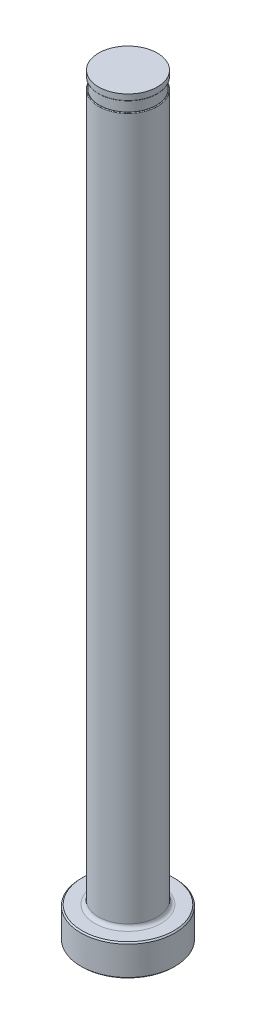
SolidWorks part; units mm, degrees
ref_plane "Front Plane" through (0, 0, 0) normal (0, 0, 1) x (1, 0, 0)
ref_plane "Top Plane" through (0, 0, 0) normal (0, 1, 0) x (1, 0, 0)
ref_plane "Right Plane" through (0, 0, 0) normal (1, 0, 0) x (0, 0, -1)
other "Configuration Table"
sketch "Sketch1" plane through (0, 0, 0) normal (0, 0, 1) x (1, 0, 0)
  line L0 (0, 259.9588) -> (0, -15.1925) construction
  line L1 (0, 0) -> (-9.525, 0)
  line L2 (-9.525, 0) -> (-9.525, 6.35)
  line L3 (-9.525, 6.35) -> (-5.9525, 6.35)
  line L4 (-5.9525, 6.35) -> (-5.9525, 152.4)
  line L5 (-5.9525, 152.4) -> (0, 152.4)
  line L6 (0, 152.4) -> (0, 0)
  dimension "L" = 152.4
  dimension "H" = 19.05
  dimension "T" = 6.35
  dimension "D" = 11.905
revolve "Revolve1" add sketch "Sketch1" angle 360 about L0
chamfer "Chamfer1" distance 0.254 angle 45 2 edges at (0, 6.35, 9.525) (0, 0, 9.525)
fillet "Fillet1" radius 0.762 1 edges at (0, 6.35, 5.9525)
sketch "Sketch2" plane through (0, 0, 0) normal (0, 0, 1) x (1, 0, 0)
  line L0 (-5.9525, 152.4) -> (-5.9525, 7.112) construction
  line L1 (-5.9525, 151.13) -> (-5.7493, 151.13)
  line L2 (-5.9525, 151.13) -> (-5.9525, 149.098)
  line L3 (-5.9525, 149.098) -> (-5.7493, 149.098)
  line L4 (-5.7493, 151.13) -> (-5.7493, 149.098)
  line L5 (5.9525, 152.4) -> (-5.9525, 152.4) construction
  line L6 (0, 153.4483) -> (0, 147.3282) construction
  dimension "D1" = 2.032
  dimension "N" = 1.27
  dimension "FD" = 0.2032
  dimension "D3" = 11.4986
revolve "Vent Relief" cut sketch "Sketch2" angle 360 about L6
sketch "Sketch3" plane through (0, 0, 0) normal (0, 0, 1) x (1, 0, 0)
  line L0 (-5.7493, 150.114) -> (-5.7493, 86.614)
  line L1 (-5.7493, 151.13) -> (-5.7493, 149.098) construction
  line L2 (-5.9525, 149.098) -> (-5.9525, 7.112) construction
  line L3 (-5.9525, 85.4964) -> (-5.9525, 150.114)
  line L4 (-5.9525, 150.114) -> (-5.7493, 150.114)
  arc A0 (-5.7493, 86.614) -> (-5.9525, 85.4964) centre (-8.9243, 86.614) cw
  dimension "D1" = 3.175
  dimension "D2" = 63.5
extrude "D-Slot" cut sketch "Sketch3" against normal through all both and the other way through all
sketch "Sketch5" plane through (0, 0, 0) normal (0, 0, 1) x (1, 0, 0)
  line L0 (-5.9525, 151.13) -> (5.9525, 151.13) construction
  line L1 (-5.9525, 152.4) -> (-5.9398, 152.4)
  line L2 (-5.9525, 152.4) -> (-5.9525, 151.13)
  line L3 (-5.9525, 151.13) -> (-5.9398, 151.13)
  line L4 (-5.9398, 152.4) -> (-5.9398, 151.13)
  line L5 (0, 152.6877) -> (0, 150.5771) construction
  dimension "VP" = 0.0127
revolve "Vent Diameter" cut sketch "Sketch5" angle 360 about L5
fillet "Fillet2" radius 0.127 2 edges at (5.9525, 149.098, 0) (0, 151.13, 5.9398)
sketch "Pocket Sketch" plane through (0, 0, 0) normal (0, 0, 1) x (1, 0, 0)
  line L0 (-9.9219, 0) -> (-9.9219, 6.3754)
  line L1 (-9.9219, 6.3754) -> (-6.9129, 6.3754)
  line L2 (-6.1509, 7.1374) -> (-6.1509, 22.225)
  line L3 (-6.1509, 22.225) -> (0, 22.225)
  line L4 (0, 22.225) -> (0, 0)
  line L5 (0, 0) -> (-9.9219, 0)
  line L6 (0, 12.6104) -> (0, -2.4989) construction
  line L7 (-9.525, 6.096) -> (-9.525, 0.254) construction
  line L8 (9.271, 6.35) -> (-9.271, 6.35) construction
  line L9 (-5.9525, 85.4964) -> (-5.9525, 7.112) construction
  line L10 (-6.9129, 6.3754) -> (-6.1509, 7.1374)
  point P3 (-6.1509, 6.3754)
  dimension "D1" = 19.8437
  dimension "D2" = 0.3969
  dimension "D3" = 0.0254
  dimension "D4" = 0.1984
  dimension "D5" = 12.3019
  dimension "D6" = 22.225
